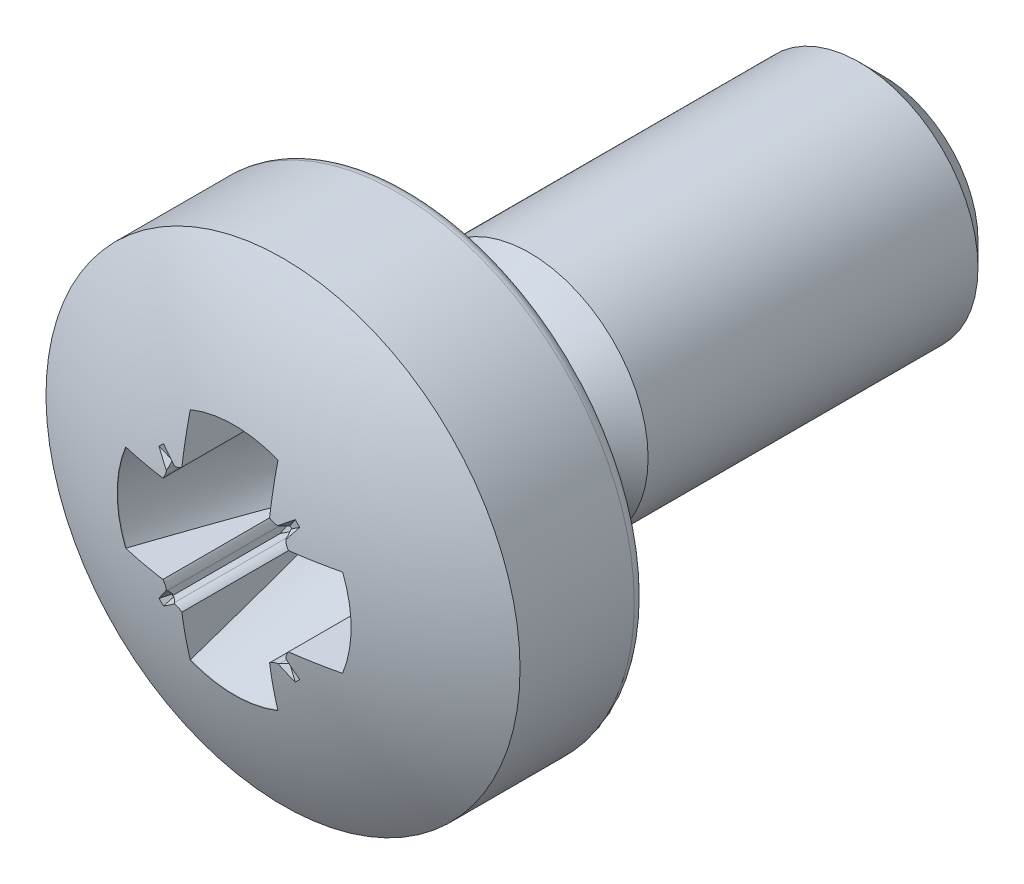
SolidWorks part; units mm, degrees
ref_plane "Plan1" through (0, 0, 0) normal (0, 0, 1) x (1, 0, 0)
ref_plane "Plan2" through (0, 0, 0) normal (0, 1, 0) x (1, 0, 0)
ref_plane "Plan3" through (0, 0, 0) normal (1, 0, 0) x (0, 0, -1)
imported_body "Vis à métaux - tête cylindrique bombée large DIN 7985 - M2x4 - 4,8"
chamfer "Chanfrein1" distance 0.2 angle 45
